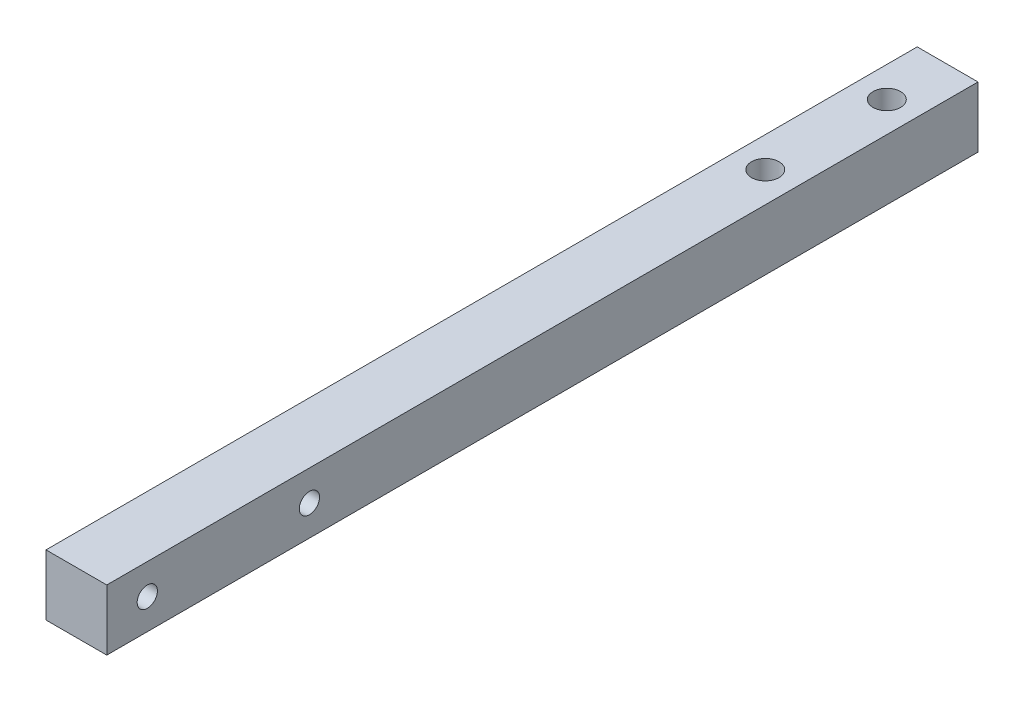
SolidWorks part; units mm, degrees
ref_plane "Plan de face" through (0, 0, 0) normal (0, 0, 1) x (1, 0, 0)
ref_plane "Plan de dessus" through (0, 0, 0) normal (0, 1, 0) x (1, 0, 0)
ref_plane "Plan de droite" through (0, 0, 0) normal (1, 0, 0) x (0, 0, -1)
sketch "Esquisse1" plane through (0, 0, 0) normal (0, 0, 1) x (1, 0, 0)
  line L1 (0, 0) -> (15, 0)
  line L2 (0, 0) -> (0, 15)
  line L3 (0, 15) -> (15, 15)
  line L4 (15, 0) -> (15, 15)
  dimension "D1" = 15
  dimension "D2" = 15
extrude "Extrusion1" add sketch "Esquisse1" along normal blind 215
hole_wizard "Trou taraudé M61" positions "Esquisse3" profile "Esquisse2" tap size "M6" standard "ISO"
sketch "Esquisse3" plane through (15, 0, 0) normal (1, 0, 0) x (0, 0, -1)
  line L0 (-215, 0) -> (-215, 15) construction
  line L1 (-215, 0) -> (0, 0) construction
  point P0 (-165, 7.5)
  point P1 (-205, 7.5)
  dimension "D1" = 10
  dimension "D2" = 40
  dimension "D3" = 7.5
sketch "Esquisse2" plane through (15, 7.5, 165) normal (0, 1, 0) x (0, 0, -1)
  line L0 (0, 0) -> (0, 15)
  line L1 (0, 15) -> (2.5, 15)
  line L2 (2.5, 15) -> (2.5, 0)
  line L5 (2.5, 0) -> (0, 0)
  line L11 (0, -6.35) -> (0, 107.95) construction
  dimension "Diamètre du trou pour taraudage jusqu'au prochain" = 5
  dimension "Profondeur du trou pour taraudage jusqu'au prochain" = 15
hole_wizard "Trou taraudé M81" positions "Esquisse5" profile "Esquisse4" tap size "M8" standard "ISO"
sketch "Esquisse5" plane through (0, 15, 0) normal (0, 1, 0) x (-1, 0, 0)
  line L0 (0, 215) -> (0, 0) construction
  line L1 (-15, 0) -> (0, 0) construction
  point P0 (-7.5, 45)
  point P1 (-7.5, 15)
  dimension "D1" = 7.5
  dimension "D2" = 15
  dimension "D3" = 30
sketch "Esquisse4" plane through (7.5, 15, 45) normal (1, 0, 0) x (0, 0, 1)
  line L0 (0, 0) -> (0, 15)
  line L1 (0, 15) -> (3.4, 15)
  line L2 (3.4, 15) -> (3.4, 0)
  line L5 (3.4, 0) -> (0, 0)
  line L11 (0, -6.35) -> (0, 107.95) construction
  dimension "Diamètre du trou pour taraudage jusqu'au prochain" = 6.8
  dimension "Profondeur du trou pour taraudage jusqu'au prochain" = 15
